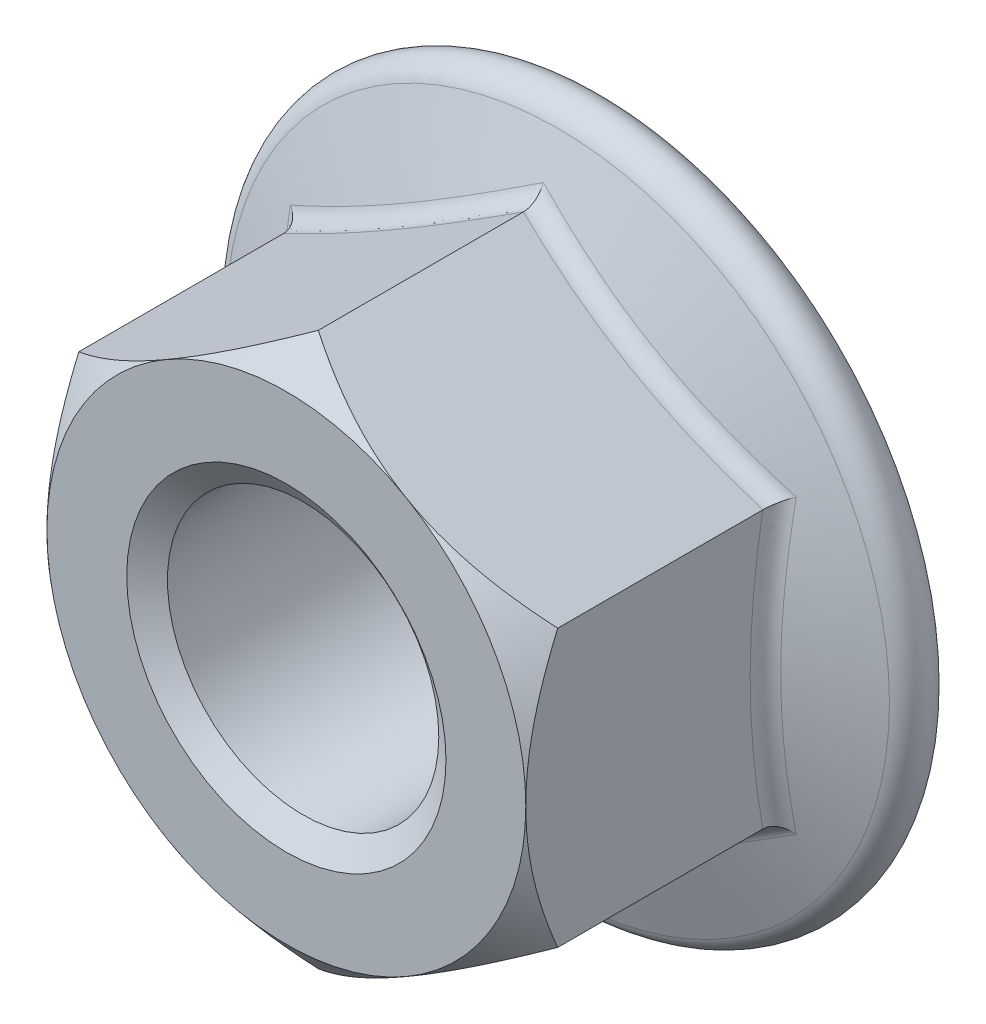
SolidWorks part; units mm, degrees
ref_plane "Plane1" through (0, 0, 0) normal (0, 0, 1) x (1, 0, 0)
ref_plane "Plane2" through (0, 0, 0) normal (0, 1, 0) x (1, 0, 0)
ref_plane "Plane3" through (0, 0, 0) normal (1, 0, 0) x (0, 0, -1)
sketch "BaseNutSke" plane through (0, 0, 0) normal (0, 0, 1) x (1, 0, 0)
  line L6 (7.5, 4.3301) -> (7.5, -4.3301)
  line L7 (-7.5, 4.3301) -> (-7.5, -4.3301)
  line L8 (7.5, 4.3301) -> (0, 8.6603)
  line L9 (0, 8.6603) -> (-7.5, 4.3301)
  line L10 (-7.5, -4.3301) -> (0, -8.6603)
  line L11 (0, -8.6603) -> (7.5, -4.3301)
  circle A0 centre (0, 0) radius 4.25
  dimension "D4" = 7.5
  dimension "Tap_drill" = 8.5
  dimension "D1" = 120
  dimension "D2" = 7.5
  dimension "D3" = 7.5
  dimension "Width_flats" = 15
extrude "BaseNut" add sketch "BaseNutSke" against normal blind 10
sketch "Sketch6" plane through (0, 0, 0) normal (1, 0, 0) x (0, 0, -1)
  line L0 (6.2648, 4.25) -> (8.5, 10.3912)
  line L1 (10, 4.25) -> (10, 10.1267)
  line L2 (8.5, 32.2909) -> (8.5, 10.3912) construction
  line L3 (23.7075, 10.9) -> (19.5103, 10.9) construction
  line L4 (10, 4.25) -> (6.2648, 4.25)
  line L5 (23.7075, -10.9) -> (19.5103, -10.9) construction
  line L6 (10, 4.3301) -> (10, 8.6603) construction
  line L7 (0, 0) -> (32.9582, 0) construction
  line L8 (10, -4.25) -> (6.2648, -4.25) construction
  line L9 (10, 0) -> (0, 0) construction
  arc A0 (10, 10.1267) -> (8.5, 10.3912) centre (9.2267, 10.1267) ccw
  dimension "D1" = 8.5
  dimension "D2" = 20
  dimension "Flange_dia" = 21.8
  dimension "Flange_thickness" = 1.5
revolve "Flange" add sketch "Sketch6" angle 360 about L7
sketch "Sketch3" plane through (0, 0, 0) normal (1, 0, 0) x (0, 0, -1)
  line L0 (10, 7.5) -> (9, 8.6603) construction
  line L1 (9, 8.6603) -> (9, 21.3603) construction
  line L2 (9, 21.3603) -> (22.7, 21.3603) construction
  line L3 (22.7, 21.3603) -> (22.7, 7.5) construction
  line L4 (22.7, 7.5) -> (10, 7.5) construction
  line L5 (10, 4.3301) -> (10, 8.6603) construction
  line L6 (7.87, 8.6603) -> (0, 8.6603) construction
  line L7 (0, 0) -> (38.6776, 0) construction
  line L8 (10, 0) -> (0, 0) construction
  line L9 (5, 8.6603) -> (5, 44.222) construction
  line L10 (1, 21.3603) -> (-12.7, 21.3603)
  line L11 (-12.7, 21.3603) -> (-12.7, 7.5)
  line L12 (-12.7, 7.5) -> (0, 7.5)
  line L13 (0, 7.5) -> (1, 8.6603)
  line L14 (1, 8.6603) -> (1, 21.3603)
  line L16 (7.87, 8.6603) -> (0, 8.6603) construction
  dimension "D1" = 7.5
  dimension "D2" = 1
  dimension "D3" = 12.7
  dimension "D4" = 12.7
  dimension "D5" = 5
revolve "Double-Chamfer" cut sketch "Sketch3" angle 360 about L7
fillet "FlangeFillet" radius 0.6 6 edges
sketch "Sketch5"
  line L0 (9.9746, 5) -> (9.3969, 4.175)
  line L1 (10.0254, 5) -> (9.9746, 5)
  line L2 (10.0254, 5) -> (10.0254, 4.175)
  line L3 (10.0254, 4.175) -> (9.3969, 4.175)
  line L6 (-0.0508, 5) -> (0, 5)
  line L7 (0, 5) -> (0.5777, 4.175)
  line L9 (0.5777, 4.175) -> (-0.0508, 4.175)
  line L10 (-0.0508, 4.175) -> (-0.0508, 5)
  line L11 (25.0375, 0) -> (38.388, 0) construction
  line L12 (10, 0) -> (0, 0) construction
pattern_linear "ThdSchPat" [suppressed]
revolve "ThreadSchematic" cut sketch "ThdSchSke" angle 360 about L6
sketch "ThdSchSke" plane through (0, 0, 0) normal (0, 1, 0) x (1, 0, 0)
  line L0 (-5, 0.0254) -> (-4.25, 0.5506)
  line L1 (-4.25, 0.5506) -> (-2.125, 0.5506)
  line L2 (-2.125, 0.5506) -> (-2.125, -0.4998)
  line L3 (-2.125, -0.4998) -> (-4.25, -0.4998)
  line L4 (-4.25, -0.4998) -> (-5, 0.0254)
  line L5 (-3.175, 1.5) -> (3.175, 1.5) construction
  line L6 (0, 1.5) -> (0, -2.9874) construction
  line L7 (0, 9.4494) -> (0, 0.5252) construction
  dimension "D1" = 0.0254
  dimension "VeeAngle" = 70
  dimension "SideAngle" = 55
  dimension "OverCut" = 4.25
  dimension "Tap_Drill" = 8.5
  dimension "Advance" = 1.5
  dimension "Thread_major" = 10
revolve "EndChamfer" cut sketch "Sketch5" angle 360 about L11
equation "\"D2@BaseNutSke\" = \"Width_flats@BaseNutSke\" / 2"
equation "\"D3@BaseNutSke\" = \"Width_flats@BaseNutSke\" / 2"
equation "\"D1@Sketch3\" = \"Width_flats@BaseNutSke\" /2"
equation "\"D2@Sketch3\" = \"Thread_major@ThreadCosmetic\" *.1"
equation "\"D4@BaseNutSke\" = \"D3@BaseNutSke\""
equation "\"Thread_major@ThdSchSke\" = \"Thread_major@ThreadCosmetic\""
equation "\"Tap_drill@ThdSchSke\" = \"Tap_drill@BaseNutSke\""
equation "\"Overcut@ThdSchSke\" = \"Tap_drill@ThdSchSke\" * 0.5"
equation "\"Num_threads@ThdSchPat\" = int(  ( \"Thickness@BaseNut\" - 0.0508 ) / \"Advance@ThdSchSke\" + 0.999 )  + 1"
equation "\"Advance@ThdSchPat\" = ( \"Thickness@BaseNut\" - 0.0508 ) /  (\"Num_threads@ThdSchPat\" - 1) 'relax it"
equation "' \"Num_threads@ThdSchPat\" = \"Num_threads@ThdSchPat\" - sgn( \"Num_threads@ThdSchPat\" - 1) '---chamfered tips only---"
equation "\"ThreadMajor@Sketch5\" = \"Thread_major@ThreadCosmetic\" * 0.5"
equation "\"ChamferDepth@Sketch5\" = (\"Thread_major@ThreadCosmetic\" - \"Tap_drill@BaseNutSke\") * 0.55"
equation "\"Offset1@Sketch5\" = \"Thickness@BaseNut\" + 0.0254"
equation "\"Offset2@Sketch5\" = \"Offset1@Sketch5\" + 0.0508"
equation "\"D1@Sketch6\" = \"Tap_drill@BaseNutSke\""
equation "\"D5@Sketch3\" = \"Thickness@BaseNut\" / 2"
